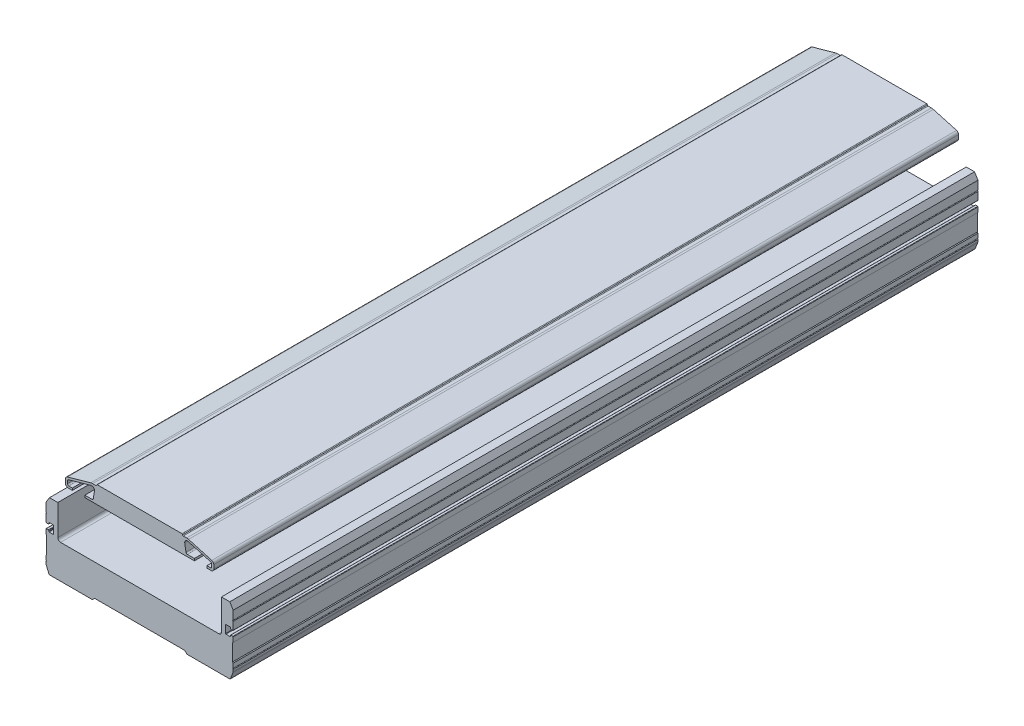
SolidWorks part; units mm, degrees
ref_plane "前视基准面" through (0, 0, 0) normal (0, 0, 1) x (1, 0, 0)
ref_plane "上视基准面" through (0, 0, 0) normal (0, 1, 0) x (1, 0, 0)
ref_plane "右视基准面" through (0, 0, 0) normal (1, 0, 0) x (0, 0, -1)
sketch "草图1" plane through (0, 0, 0) normal (0, 0, 1) x (1, 0, 0)
  line B0 (-39.5, 59.4) -> (39.5, 59.4)
  line B1 (39.5, 59.4) -> (39.5, 60.9)
  line B2 (39.5, 60.9) -> (34.4, 60.9)
  line B3 (33.4138, 61.7343) -> (32.5361, 66.9593)
  line B4 (35.0485, 69.2164) -> (51.27, 64.6675)
  line B5 (52, 63.7046) -> (52, 61.9)
  line B6 (51, 60.9) -> (48.5, 60.9)
  line B7 (48.5, 60.9) -> (48.5, 59.4)
  line B8 (48.5, 59.4) -> (51.5, 59.4)
  line B9 (53.5, 61.4) -> (53.5, 64.0837)
  line B10 (52.04, 66.0094) -> (35.2622, 70.7143)
  line B11 (33.9122, 70.9) -> (31.5, 70.9)
  line B12 (30.5, 71.9) -> (-30.5, 71.9)
  line B13 (-31.5, 70.9) -> (-33.9122, 70.9)
  line B14 (-35.2622, 70.7143) -> (-52.04, 66.0094)
  line B15 (-53.5, 64.0837) -> (-53.5, 61.4)
  line B16 (-51.5, 59.4) -> (-48.5, 59.4)
  line B17 (-48.5, 59.4) -> (-48.5, 60.9)
  line B18 (-48.5, 60.9) -> (-51, 60.9)
  line B19 (-52, 61.9) -> (-52, 63.7046)
  line B20 (-51.27, 64.6675) -> (-35.0485, 69.2164)
  line B21 (-32.5361, 66.9593) -> (-33.4138, 61.7343)
  line B22 (-34.4, 60.9) -> (-39.5, 60.9)
  line B23 (-39.5, 60.9) -> (-39.5, 59.4)
  line B24 (-67, 22) -> (-67, 10)
  line B25 (-67, 10) -> (-67.5, 9.5)
  line B26 (-67.5, 9.5) -> (-67.5, 6.375)
  line B27 (-67.5, 5.625) -> (-67.5, 4.3812)
  line B28 (-67.36, 3.6469) -> (-65.5064, -1.0289)
  line B29 (-65.16, -1.6) -> (-34.1, -1.6)
  line B30 (-34.1, -1.6) -> (-32.5, 0)
  line B31 (-32.5, 0) -> (32.5, 0)
  line B32 (32.5, 0) -> (34.1, -1.6)
  line B33 (34.1, -1.6) -> (65.16, -1.6)
  line B34 (65.5064, -1.0289) -> (67.36, 3.6469)
  line B35 (67.5, 4.3812) -> (67.5, 5.625)
  line B36 (67.5, 6.375) -> (67.5, 9.5)
  line B37 (67.5, 9.5) -> (67, 10)
  line B38 (67, 10) -> (67, 22)
  line B39 (67, 22) -> (67.5, 22.5)
  line B40 (67.5, 22.5) -> (67.5, 25.9)
  line B41 (67.2, 26.2) -> (65.8, 26.2)
  line B42 (65.5, 25.9) -> (65.5, 25.3)
  line B43 (65.2, 25) -> (62.3, 25)
  line B44 (62, 25.3) -> (62, 30.7)
  line B45 (62.3, 31) -> (65.2, 31)
  line B46 (65.5, 30.7) -> (65.5, 30.1)
  line B47 (65.8, 29.8) -> (67.2, 29.8)
  line B48 (67.5, 30.1) -> (67.5, 35.625)
  line B49 (67.5, 36.375) -> (67.5, 42.6)
  line B50 (67.5, 42.6) -> (65, 46.6)
  line B51 (65, 46.6) -> (59, 46.6)
  line B52 (59, 46.6) -> (59, 24.7)
  line B53 (57, 22.7) -> (-57, 22.7)
  line B54 (-59, 24.7) -> (-59, 46.6)
  line B55 (-59, 46.6) -> (-65, 46.6)
  line B56 (-65, 46.6) -> (-67.5, 42.6)
  line B57 (-67.5, 42.6) -> (-67.5, 36.375)
  line B58 (-67.5, 35.625) -> (-67.5, 30.1)
  line B59 (-67.2, 29.8) -> (-65.8, 29.8)
  line B60 (-65.5, 30.1) -> (-65.5, 30.7)
  line B61 (-65.2, 31) -> (-62.3, 31)
  line B62 (-62, 30.7) -> (-62, 25.3)
  line B63 (-62.3, 25) -> (-65.2, 25)
  line B64 (-65.5, 25.3) -> (-65.5, 25.9)
  line B65 (-65.8, 26.2) -> (-67.2, 26.2)
  line B66 (-67.5, 25.9) -> (-67.5, 22.5)
  line B67 (-67.5, 22.5) -> (-67, 22)
  arc B68 (33.4138, 61.7343) -> (34.4, 60.9) centre (34.4, 61.9) ccw
  arc B69 (35.0485, 69.2164) -> (32.5361, 66.9593) centre (34.5085, 67.2906) ccw
  arc B70 (52, 63.7046) -> (51.27, 64.6675) centre (51, 63.7046) ccw
  arc B71 (51, 60.9) -> (52, 61.9) centre (51, 61.9) ccw
  arc B72 (51.5, 59.4) -> (53.5, 61.4) centre (51.5, 61.4) ccw
  arc B73 (53.5, 64.0837) -> (52.04, 66.0094) centre (51.5, 64.0837) ccw
  arc B74 (35.2622, 70.7143) -> (33.9122, 70.9) centre (33.9122, 65.9) ccw
  arc B75 (31, 71.4) -> (31.5, 70.9) centre (31.5, 71.4) ccw
  arc B76 (31, 71.4) -> (30.5, 71.9) centre (30.5, 71.4) ccw
  arc B77 (-30.5, 71.9) -> (-31, 71.4) centre (-30.5, 71.4) ccw
  arc B78 (-31.5, 70.9) -> (-31, 71.4) centre (-31.5, 71.4) ccw
  arc B79 (-33.9122, 70.9) -> (-35.2622, 70.7143) centre (-33.9122, 65.9) ccw
  arc B80 (-52.04, 66.0094) -> (-53.5, 64.0837) centre (-51.5, 64.0837) ccw
  arc B81 (-53.5, 61.4) -> (-51.5, 59.4) centre (-51.5, 61.4) ccw
  arc B82 (-52, 61.9) -> (-51, 60.9) centre (-51, 61.9) ccw
  arc B83 (-51.27, 64.6675) -> (-52, 63.7046) centre (-51, 63.7046) ccw
  arc B84 (-32.5361, 66.9593) -> (-35.0485, 69.2164) centre (-34.5085, 67.2906) ccw
  arc B85 (-34.4, 60.9) -> (-33.4138, 61.7343) centre (-34.4, 61.9) ccw
  arc B86 (-67.5, 5.625) -> (-67.5, 6.375) centre (-67.5, 6) ccw
  arc B87 (-67.5, 4.3812) -> (-67.36, 3.6469) centre (-65.5, 4.382) ccw
  arc B88 (-65.5064, -1.0289) -> (-65.16, -1.6) centre (-63.6472, -0.2918) ccw
  arc B89 (65.16, -1.6) -> (65.5064, -1.0289) centre (63.6472, -0.2918) ccw
  arc B90 (67.36, 3.6469) -> (67.5, 4.3812) centre (65.5, 4.382) ccw
  arc B91 (67.5, 6.375) -> (67.5, 5.625) centre (67.5, 6) ccw
  arc B92 (67.5, 25.9) -> (67.2, 26.2) centre (67.2, 25.9) ccw
  arc B93 (65.8, 26.2) -> (65.5, 25.9) centre (65.8, 25.9) ccw
  arc B94 (65.2, 25) -> (65.5, 25.3) centre (65.2, 25.3) ccw
  arc B95 (62, 25.3) -> (62.3, 25) centre (62.3, 25.3) ccw
  arc B96 (62.3, 31) -> (62, 30.7) centre (62.3, 30.7) ccw
  arc B97 (65.5, 30.7) -> (65.2, 31) centre (65.2, 30.7) ccw
  arc B98 (65.5, 30.1) -> (65.8, 29.8) centre (65.8, 30.1) ccw
  arc B99 (67.2, 29.8) -> (67.5, 30.1) centre (67.2, 30.1) ccw
  arc B100 (67.5, 36.375) -> (67.5, 35.625) centre (67.5, 36) ccw
  arc B101 (57, 22.7) -> (59, 24.7) centre (57, 24.7) ccw
  arc B102 (-59, 24.7) -> (-57, 22.7) centre (-57, 24.7) ccw
  arc B103 (-67.5, 35.625) -> (-67.5, 36.375) centre (-67.5, 36) ccw
  arc B104 (-67.5, 30.1) -> (-67.2, 29.8) centre (-67.2, 30.1) ccw
  arc B105 (-65.8, 29.8) -> (-65.5, 30.1) centre (-65.8, 30.1) ccw
  arc B106 (-65.2, 31) -> (-65.5, 30.7) centre (-65.2, 30.7) ccw
  arc B107 (-62, 30.7) -> (-62.3, 31) centre (-62.3, 30.7) ccw
  arc B108 (-62.3, 25) -> (-62, 25.3) centre (-62.3, 25.3) ccw
  arc B109 (-65.5, 25.3) -> (-65.2, 25) centre (-65.2, 25.3) ccw
  arc B110 (-65.5, 25.9) -> (-65.8, 26.2) centre (-65.8, 25.9) ccw
  arc B111 (-67.2, 26.2) -> (-67.5, 25.9) centre (-67.2, 25.9) ccw
sketch_block_instance "块4-1"
sketch_block "块4"
extrude "凸台-拉伸1" add sketch "草图1" against normal blind 537
hole_wizard "打孔尺寸(%根据)内六角圆柱头螺钉的类型1" positions "草图3" profile "草图4" counterbore size "M6" standard "GB"
sketch "草图3" plane through (0, 46.6, 0) normal (0, 1, 0) x (1, 0, 0)
  line L4 (34.1, 537) -> (65.16, 537) construction
  line L5 (0, 537) -> (0, 1140.2602) construction
  line L6 (-32.5, 537) -> (32.5, 537) construction
  point P0 (-53, 465.5)
  point P2 (53, 465.5)
  point P13 (53, 265.5)
  point P15 (-53, 265.5)
  point P22 (53, 65.5)
  point P24 (-53, 65.5)
  point P25 (53, -134.5)
  point P27 (-53, -134.5)
  point P29 (53, -334.5)
  point P31 (-53, -334.5)
  point P33 (53, -534.5)
  point P35 (-53, -534.5)
  point P45 (-53, -734.5)
  point P47 (53, -734.5)
  dimension "D1" = 106
  dimension "D2" = 200
  dimension "D3" = 71.5
  dimension "D4" = 200
  dimension "D5" = 200
  dimension "D6" = 200
  dimension "D7" = 200
  dimension "D8" = 200
sketch "草图4" plane through (-53, 46.6, -465.5) normal (1, 0, 0) x (0, 0, 1)
  line L0 (0, 0) -> (0, 48.2)
  line L1 (0, 48.2) -> (3.5, 48.2)
  line L3 (3.5, 48.2) -> (3.5, 41)
  line L4 (3.5, 41) -> (5.5, 41)
  line L5 (5.5, 41) -> (5.5, 0)
  line L7 (5.5, 0) -> (0, 0)
  line L11 (0, -6.35) -> (0, 107.95) construction
  dimension "通孔孔直径" = 7
  dimension "通孔孔深度" = 48.2
  dimension "柱形沉头孔直径" = 11
  dimension "柱形沉头孔深度" = 41
hole_wizard "M6 螺纹孔0" positions "草图5" profile "草图6" tap size "M6" standard "GB"
sketch "草图5" plane through (0, -1.6, 0) normal (0, -1, 0) x (-1, 0, 0)
  line L0 (53, 465.5) -> (53, 475.5) construction
  line L1 (-53, 465.5) -> (-53, 475.5) construction
  line L4 (65.16, 537) -> (34.1, 537) construction
  point P0 (53, 475.5)
  point P2 (-53, 475.5)
  point P12 (53, 275.5)
  point P14 (-53, 275.5)
  point P19 (-53, 75.5)
  point P21 (53, 75.5)
  point P23 (-53, -124.5)
  point P25 (53, -124.5)
  point P27 (-53, -324.5)
  point P29 (53, -324.5)
  point P31 (-53, -524.5)
  point P33 (53, -524.5)
  point P36 (53, -724.5)
  point P38 (-53, -724.5)
  dimension "D1" = 61.5
  dimension "D2" = 200
  dimension "D3" = 200
  dimension "D4" = 200
  dimension "D5" = 200
  dimension "D6" = 200
  dimension "D7" = 200
sketch "草图6" plane through (-53, -1.6, -475.5) normal (1, 0, 0) x (0, 0, -1)
  line L0 (0, 0) -> (0, 16.5022)
  line L1 (0, 16.5022) -> (2.5, 15)
  line L2 (2.5, 15) -> (2.5, 0)
  line L5 (2.5, 0) -> (0, 0)
  line L10 (0, 16.5022) -> (-2.5, 15) construction
  line L11 (0, -6.35) -> (0, 107.95) construction
  dimension "螺纹孔钻头直径" = 5
  dimension "螺纹孔钻头深度" = 15
  dimension "导头角度" = 118
